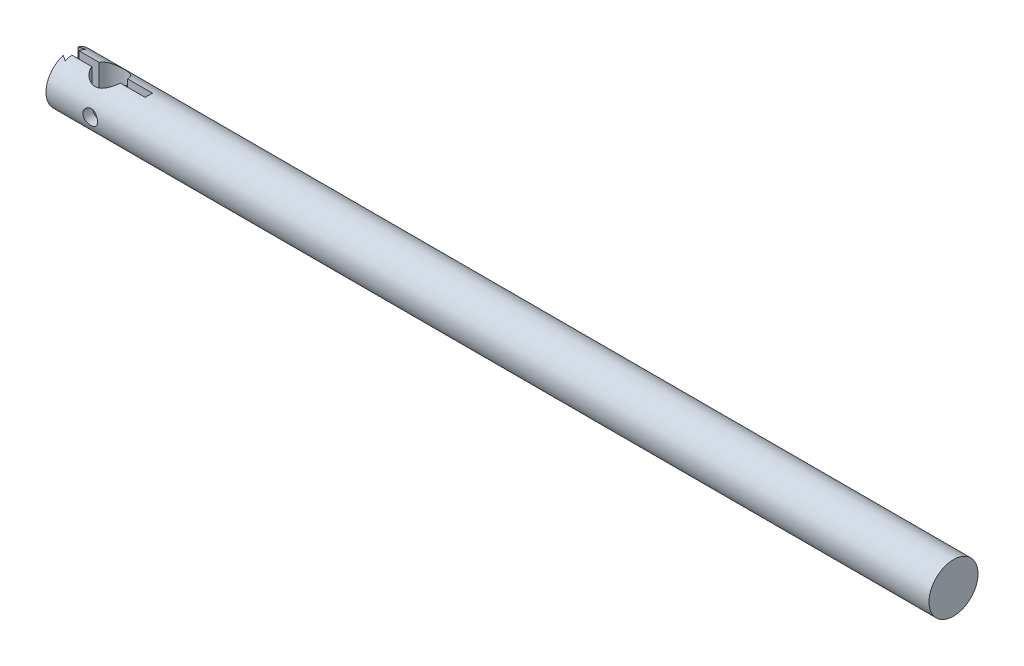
SolidWorks part; units mm, degrees
ref_plane "Face" through (0, 0, 0) normal (0, 0, 1) x (1, 0, 0)
ref_plane "Dessus" through (0, 0, 0) normal (0, 1, 0) x (1, 0, 0)
ref_plane "Droite" through (0, 0, 0) normal (1, 0, 0) x (0, 0, -1)
sketch "Esquisse1" plane through (0, 0, 0) normal (0, 0, 1) x (1, 0, 0)
  line L0 (0, 0) -> (0, 5)
  line L1 (0, 5) -> (180, 5)
  line L2 (180, 5) -> (180, 0)
  line L3 (-14.4388, 0) -> (138.9499, 0) construction
  line L4 (0, 0) -> (180, 0)
  dimension "D1" = 10
  dimension "D2" = 180
revolve "Révolution1" add sketch "Esquisse1" angle 360 about L3
sketch "Esquisse2" plane through (0, 0, 0) normal (0, 1, 0) x (1, 0, 0)
  line L0 (0, -1.5) -> (1, -2.0774)
  line L1 (0, 5) -> (0, -5) construction
  line L2 (1, -2.0774) -> (1, 2.0774)
  line L3 (1, 2.0774) -> (0, 1.5)
  line L4 (0, 1.5) -> (0, -1.5)
  dimension "D1" = 1
  dimension "D2" = 1.5
  dimension "D3" = 3
  dimension "D4" = 120
  dimension "D5" = 60
extrude "Enlèv. mat.-Extru.1" cut sketch "Esquisse2" against normal mid plane 40
sketch "Esquisse3" plane through (0, 0, 0) normal (0, 1, 0) x (1, 0, 0)
  line L0 (1, 0.75) -> (16, 0.75)
  line L1 (1, 2.0774) -> (1, -2.0774) construction
  line L2 (16, 0.75) -> (16, -0.75)
  line L3 (16, -0.75) -> (1, -0.75)
  line L4 (1, -0.75) -> (1, 0.75)
  dimension "D1" = 15
  dimension "D2" = 1.5
  dimension "D3" = 0.75
extrude "Enlèv. mat.-Extru.2" cut sketch "Esquisse3" against normal mid plane 40
sketch "Esquisse4" plane through (0, 0, 0) normal (0, 0, 1) x (1, 0, 0)
  circle A0 centre (9, 0) radius 1.5
  dimension "D1" = 3
  dimension "D2" = 9
extrude "Enlèv. mat.-Extru.3" cut sketch "Esquisse4" against normal mid plane 40
sketch "Esquisse5" plane through (0, 0, 0) normal (0, 1, 0) x (1, 0, 0)
  circle A0 centre (8, 0) radius 3
  dimension "D1" = 6
  dimension "D2" = 8
extrude "Enlèv. mat.-Extru.4" cut sketch "Esquisse5" against normal mid plane 30
